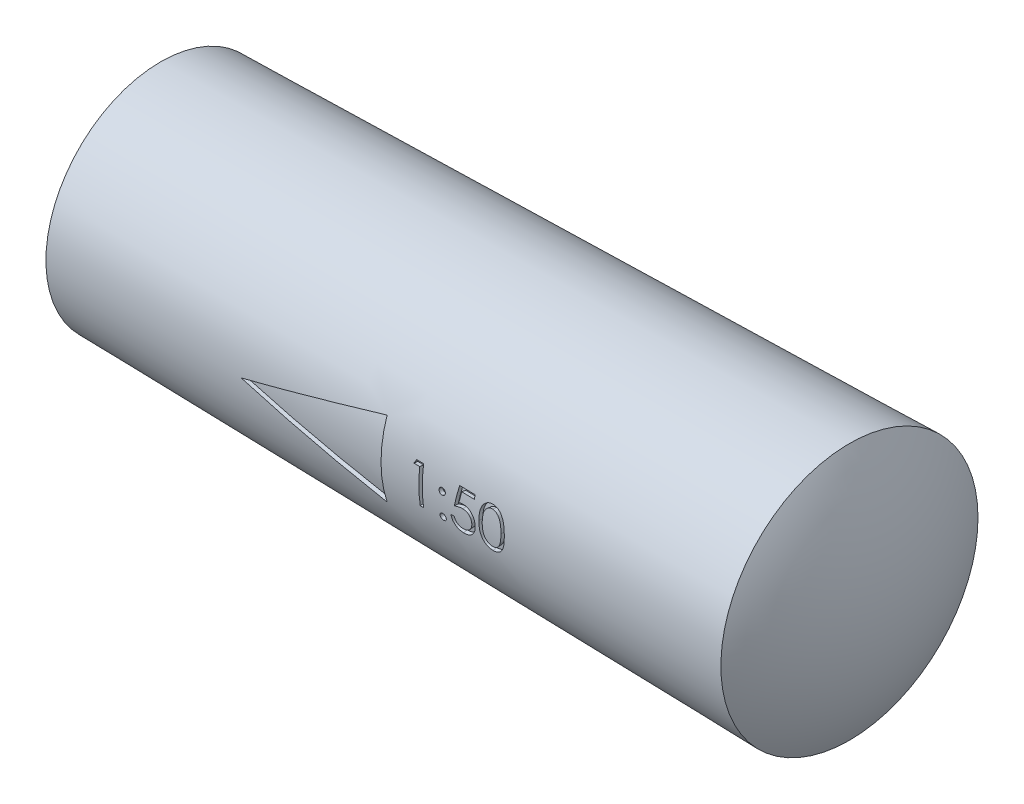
SolidWorks part; units mm, degrees
ref_plane "Front Plane" through (0, 0, 0) normal (0, 0, 1) x (1, 0, 0)
ref_plane "Top Plane" through (0, 0, 0) normal (0, 1, 0) x (1, 0, 0)
ref_plane "Right Plane" through (0, 0, 0) normal (1, 0, 0) x (0, 0, -1)
sketch "Sketch1" plane through (0, 0, 0) normal (1, 0, 0) x (0, 0, -1)
  circle A0 centre (0, 0) radius 3
  dimension "D1" = 6
extrude "Extrude1" add sketch "Sketch1" along normal mid plane 18
draft "Draft1" type of draft neutral plane draft angle 1.146 faces to draft 1 parameters "D1"=1.146
sketch "Sketch2" plane through (0, 0, 0) normal (0, 0, 1) x (1, 0, 0)
  line L0 (-9, 0) -> (-9, 3)
  line L1 (-9, 3) -> (-9, -3) construction
  line L2 (-9, 0) -> (-9.9, 0)
  line L3 (-9.9, 0) -> (-9.9, -3.18) construction
  line L4 (9, 0) -> (9, 3.36)
  line L5 (9, -3.36) -> (9, 3.36) construction
  line L6 (9, 0) -> (9.9, 0)
  line L7 (9.9, 0) -> (9.9, -3.18) construction
  line L8 (-9, -3) -> (9, -3.36) construction
  arc A0 (-9.9, 0) -> (-9, 3) centre (-4.45, 0) cw
  arc A1 (9.9, 0) -> (9, 3.36) centre (3.178, 0) ccw
  point P14 (0, -3.18)
revolve "Revolve1" add sketch "Sketch2" angle 360 about L2
sketch "Sketch5" plane through (0, 0, 0) normal (0, 0, 1) x (1, 0, 0)
  line L0 (0, 3.18) -> (0, -3.18) construction
  line L1 (9, 3.36) -> (-9, 3) construction
  line L2 (-9, -3) -> (9, -3.36) construction
ref_plane "Plane2" through (0, 0, 0) normal (-0.02, 0, 0.9998) x (0.9998, 0, 0.02)
sketch "Sketch6" plane through (0, 0, 0) normal (-0.02, 0, 0.9998) x (0.9998, 0, 0.02)
  line L0 (0, 0) -> (0, 1)
  line L1 (0, 3.18) -> (0, -3.18) construction
  line L2 (0, 1) -> (-3.7321, 0)
  line L3 (-3.7321, 0) -> (0, -1)
  line L4 (0, -1) -> (0, 0)
  line L5 (0, -0.5) -> (4, -0.5) construction
  text T0 "1:50" font "Century Gothic" height 1
  dimension "D1" = 2
  dimension "D2" = 30
  dimension "D3" = 4
wrap "Wrap2" sketch "Sketch6" wrap type deboss source sketch "Sketch6" thickness 0.1 parameters "D1"=0.1
equation "\"D2@Sketch2\" = \"D1@Sketch2\""
